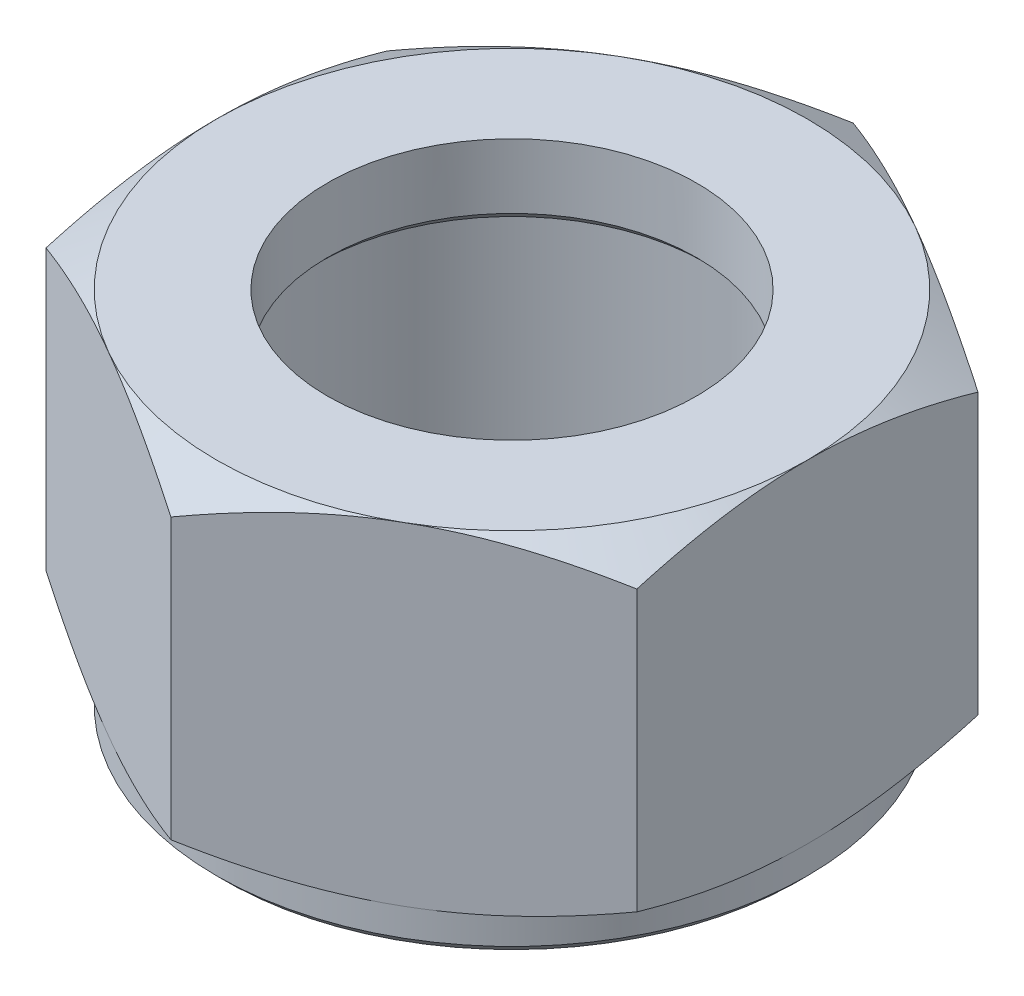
SolidWorks part; units mm, degrees
ref_plane "Přední rovina" through (0, 0, 0) normal (0, 0, 1) x (1, 0, 0)
ref_plane "Horní rovina" through (0, 0, 0) normal (0, 1, 0) x (1, 0, 0)
ref_plane "Pravá rovina" through (0, 0, 0) normal (1, 0, 0) x (0, 0, -1)
sketch "Skica1" plane through (0, 0, 0) normal (0, 1, 0) x (1, 0, 0)
  line L1 (0, 18.4752) -> (-16, 9.2376)
  line L2 (-16, 9.2376) -> (-16, -9.2376)
  line L3 (-16, -9.2376) -> (0, -18.4752)
  line L4 (0, -18.4752) -> (16, -9.2376)
  line L5 (16, -9.2376) -> (16, 9.2376)
  line L6 (16, 9.2376) -> (0, 18.4752)
  circle A0 centre (0, 0) radius 16 construction
extrude "Přidat vysunutím1" add sketch "Skica1" along normal blind 18
sketch "Skica2" plane through (0, 18, 0) normal (0, 1, 0) x (1, 0, 0)
  circle A0 centre (0, 0) radius 16
extrude "Odebrat vysunutím1" cut sketch "Skica2" against normal blind 18 draft 60 flip side to cut
sketch "Skica3" plane through (0, 0, 0) normal (0, -1, 0) x (1, 0, 0)
  circle A0 centre (0, 0) radius 16
extrude "Odebrat vysunutím2" cut sketch "Skica3" against normal blind 18 draft 60 flip side to cut
sketch "Skica4" plane through (0, 0, 0) normal (0, -1, 0) x (1, 0, 0)
  circle A0 centre (0, 0) radius 16
extrude "Přidat vysunutím2" add sketch "Skica4" along normal blind 2
chamfer "Zkosení1" distance 0.5 angle 45 1 edges at (0, -2, -16)
sketch "Skica5" plane through (0, -2, 0) normal (0, -1, 0) x (1, 0, 0)
  circle A0 centre (0, 0) radius 13
extrude "Odebrat vysunutím3" cut sketch "Skica5" against normal blind 16
sketch "Skica6" plane through (0, 18, 0) normal (0, 1, 0) x (1, 0, 0)
  circle A0 centre (0, 0) radius 10
extrude "Odebrat vysunutím4" cut sketch "Skica6" against normal up to next
chamfer "Zkosení2" distance 0.5 angle 45 1 edges at (0, 14, -10)
